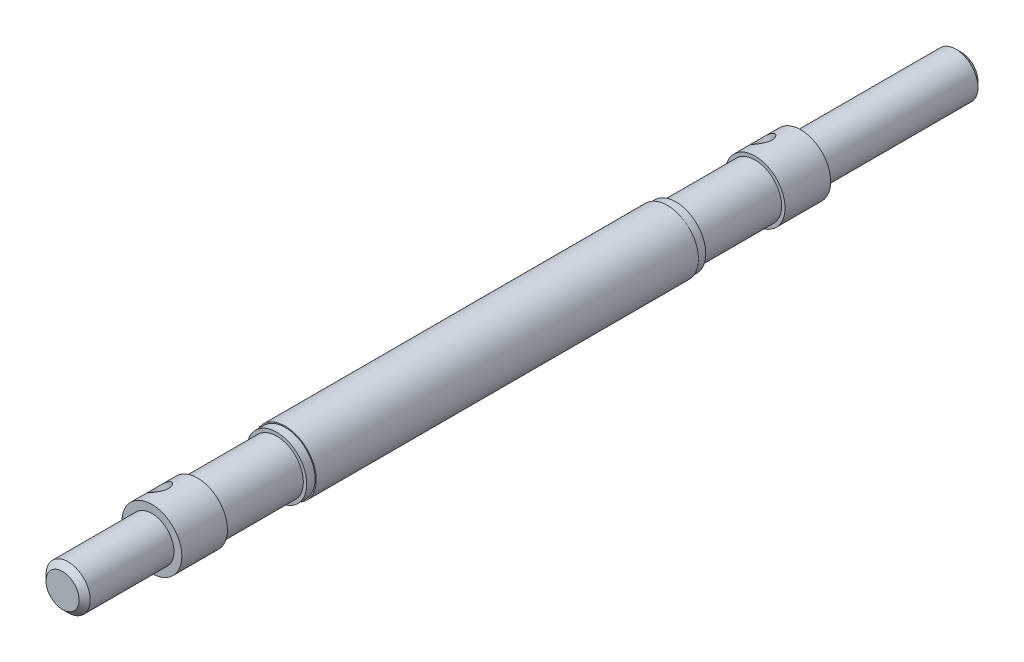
SolidWorks part; units mm, degrees
ref_plane "Plan de face" through (0, 0, 0) normal (0, 0, 1) x (1, 0, 0)
ref_plane "Plan de dessus" through (0, 0, 0) normal (0, 1, 0) x (1, 0, 0)
ref_plane "Plan de droite" through (0, 0, 0) normal (1, 0, 0) x (0, 0, -1)
imported_body "Importée1"
sketch "Esquisse1" plane through (0, 0, -160.5) normal (0, 0, -1) x (-1, 0, 0)
  circle A0 centre (0, 0) radius 7.9
  dimension "D1" = 15.8
extrude "F1 chariotage 1 long" cut sketch "Esquisse1" against normal blind 57.4 flip side to cut
sketch "Esquisse2" plane through (0, 0, 160.5) normal (0, 0, 1) x (1, 0, 0)
  circle A0 centre (0, 0) radius 7.9
  dimension "D1" = 15.8
extrude "F1 chariotage 2 court" cut sketch "Esquisse2" against normal blind 31.9 flip side to cut
chamfer "Chanfrein1" distance 2 angle 45 2 edges at (-7.9, 0, -160.5) (7.9, 0, 160.5)
